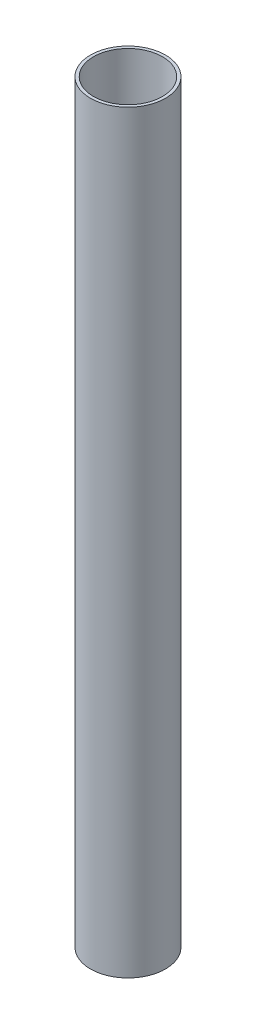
SolidWorks part; units mm, degrees
ref_plane "Front Plane" through (0, 0, 0) normal (0, 0, 1) x (1, 0, 0)
ref_plane "Top Plane" through (0, 0, 0) normal (0, 1, 0) x (1, 0, 0)
ref_plane "Right Plane" through (0, 0, 0) normal (1, 0, 0) x (0, 0, -1)
sketch "Sketch1" plane through (0, 0, 0) normal (0, 1, 0) x (1, 0, 0)
  circle A0 centre (0, 0) radius 11.1125
  dimension "D1" = 22.225
extrude "Extrude-Thin1" add sketch "Sketch1" along normal mid plane 223.52 thin
